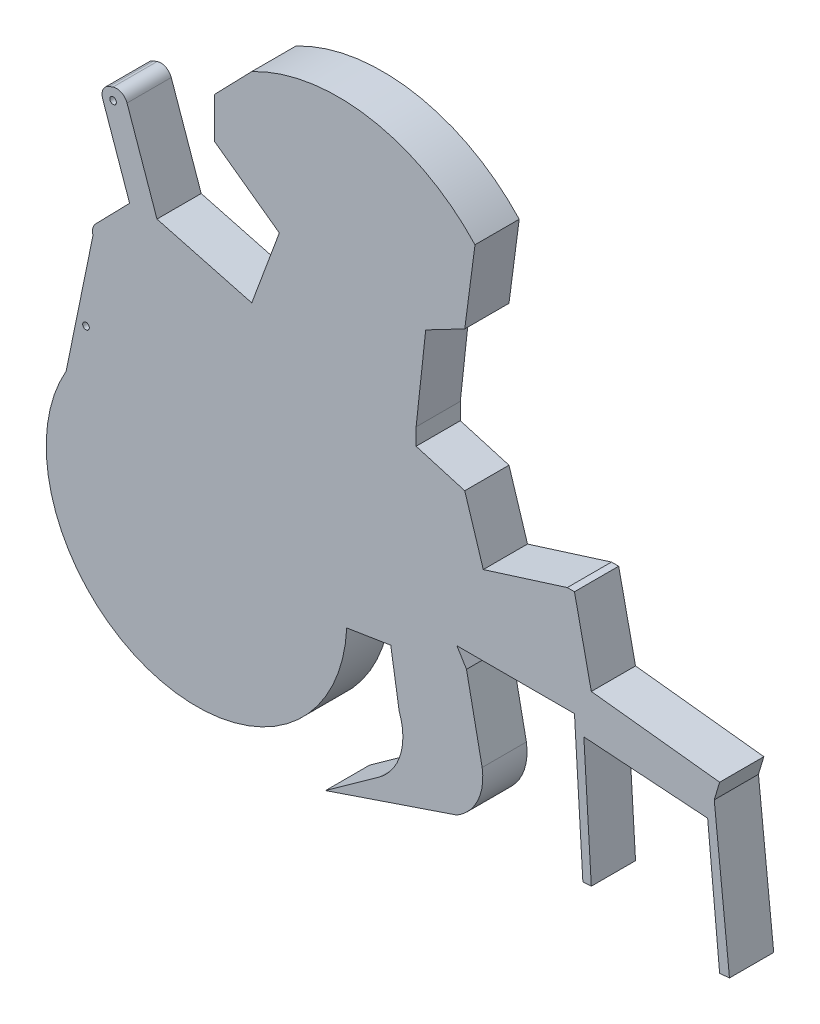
SolidWorks part; units mm, degrees
ref_plane "Plan de face" through (0, 0, 0) normal (0, 0, 1) x (1, 0, 0)
ref_plane "Plan de dessus" through (0, 0, 0) normal (0, 1, 0) x (1, 0, 0)
ref_plane "Plan de droite" through (0, 0, 0) normal (1, 0, 0) x (0, 0, -1)
sketch "Esquisse1" plane through (0, 0, 0) normal (0, 0, 1) x (1, 0, 0)
  line L0 (42.9067, -38.2561) -> (52.8593, -36.6695)
  line L7 (73.5273, -50.2781) -> (69.9856, -32.8227)
  line L8 (69.9856, -32.8227) -> (67.8155, -29.2963)
  line L9 (67.8155, -29.2963) -> (94.3992, -29.2963)
  line L10 (94.3992, -29.2963) -> (96.2981, -61.3052)
  line L11 (96.2981, -61.3052) -> (98.2063, -61.192)
  line L12 (98.2063, -61.192) -> (96.5211, -32.7853)
  line L13 (96.5211, -32.7853) -> (124.5093, -34.7216)
  line L14 (124.5093, -34.7216) -> (127.2219, -63.7466)
  line L15 (127.2219, -63.7466) -> (129.4486, -63.5385)
  line L16 (129.4486, -63.5385) -> (126.0001, -30.3778)
  line L17 (126.0001, -30.3778) -> (127.2219, -26.3124)
  line L18 (127.2219, -26.3124) -> (98.2063, -23.0573)
  line L19 (98.2063, -23.0573) -> (94.3992, -5.4252)
  line L20 (94.3992, -5.4252) -> (92.7717, -5.4252)
  line L21 (92.7717, -5.4252) -> (73.7833, -11.393)
  line L22 (73.7833, -11.393) -> (71.9077, -5.4252)
  line L23 (71.9077, -5.4252) -> (69.5912, 1.9454)
  line L24 (69.5912, 1.9454) -> (58.5926, 5.154)
  line L25 (58.5926, 5.154) -> (58.5926, 8.9517)
  line L26 (58.5926, 8.9517) -> (60.7627, 29.025)
  line L27 (60.7627, 29.025) -> (69.5912, 33.6365)
  line L28 (69.5912, 33.6365) -> (71.9077, 51.2685)
  line L29 (21.4297, 59.9489) -> (13.0206, 51.2685)
  line L30 (13.0206, 51.2685) -> (13.0206, 42.0456)
  line L31 (13.0206, 42.0456) -> (27.6687, 31.4664)
  line L32 (27.6687, 31.4664) -> (21.4297, 14.6482)
  line L33 (21.4297, 14.6482) -> (0, 20.3447)
  line L34 (0, 20.3447) -> (-6.7695, 39.686)
  line L35 (-9.955, 41.2198) -> (-10.7455, 40.9431)
  line L36 (-12.2793, 37.7575) -> (-6.1848, 20.3447)
  line L37 (-6.1848, 20.3447) -> (-13.8679, 12.4706)
  line L38 (52.8593, -36.6695) -> (54.7746, -48.684)
  line L40 (-14.4587, 9.9596) -> (-20.5378, -19.709)
  line L41 (50.3249, -63.7466) -> (38.1059, -72.5075)
  line L42 (38.1059, -72.5075) -> (67.8155, -62.4574)
  arc A0 (-20.5378, -19.709) -> (42.9067, -38.2561) centre (8.9517, -36.6204) ccw
  arc A1 (-9.955, 41.2198) -> (-6.7695, 39.686) centre (-9.1291, 38.8601) cw
  arc A2 (21.4297, 59.9489) -> (71.9077, 51.2685) centre (41.0081, 22.6915) cw
  arc A3 (-12.2793, 37.7575) -> (-10.7455, 40.9431) centre (-9.9196, 38.5834) cw
  arc A4 (-14.4587, 9.9596) -> (-13.8679, 12.4706) centre (-12.0786, 10.7247) cw
  arc A5 (50.3249, -63.7466) -> (54.7746, -48.684) centre (42.5488, -53.2609) ccw
  arc A6 (67.8155, -62.4574) -> (73.5273, -50.2781) centre (61.6643, -52.1436) ccw
  dimension "D1" = 2.5
  dimension "D2" = 2.5
  dimension "D4" = 33.9945
extrude "Extrusion1" add sketch "Esquisse1" against normal blind 10
sketch "Esquisse2" plane through (0, 0, 0) normal (0, 0, 1) x (1, 0, 0)
  circle A0 centre (-9.9196, 38.5834) radius 0.75
  circle A1 centre (-16.0483, -8.6204) radius 0.75
  arc A2 (-10.7455, 40.9431) -> (-12.2793, 37.7575) centre (-9.9196, 38.5834) ccw construction
  arc A3 (-20.5378, -19.709) -> (42.9067, -38.2561) centre (8.9517, -36.6204) ccw construction
  dimension "D1" = 25
  dimension "D3" = 1.5
  dimension "D4" = 1.5
  dimension "D2" = 28
extrude "Enlèv. mat.-Extru.1" cut sketch "Esquisse2" against normal through all
scale "Echelle1" scale about centroid uniform scaling yes scale factor 10.83
